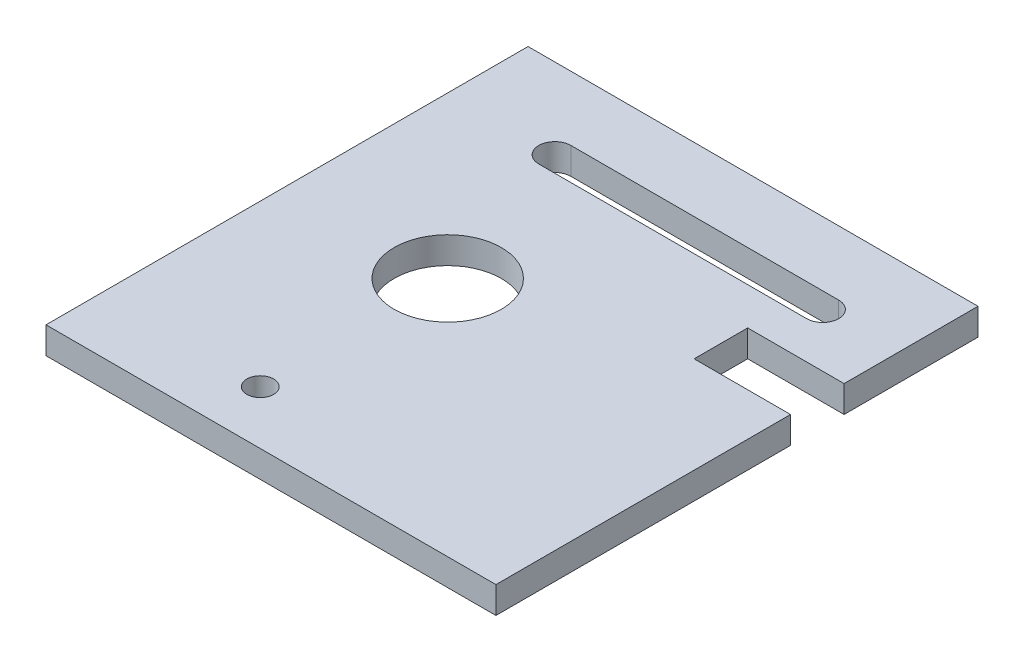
SolidWorks part; units mm, degrees
ref_plane "Front Plane" through (0, 0, 0) normal (0, 0, 1) x (1, 0, 0)
ref_plane "Top Plane" through (0, 0, 0) normal (0, 1, 0) x (1, 0, 0)
ref_plane "Right Plane" through (0, 0, 0) normal (1, 0, 0) x (0, 0, -1)
sketch "Sketch1" plane through (0, 0, 0) normal (0, 1, 0) x (1, 0, 0)
  line L0 (0, 45) -> (84, 45) construction
  line L1 (0, 0) -> (84, 0)
  line L2 (0, 0) -> (0, 90)
  line L3 (0, 90) -> (84, 90)
  line L4 (84, 0) -> (84, 90)
  circle A0 centre (30, 45) radius 10
  dimension "D3" = 30
  dimension "D4" = 20
  dimension "D1" = 84
  dimension "D2" = 90
extrude "Extrude1" add sketch "Sketch1" along normal blind 5
sketch "Sketch2" plane through (0, 5, 0) normal (0, 1, 0) x (1, 0, 0)
  line L0 (0, 90) -> (0, 0) construction
  line L1 (0, 0) -> (84, 0) construction
  point P0 (30, 10)
  dimension "D1" = 30
  dimension "D2" = 10
hole_wizard "M6 Tapped Hole1" positions "3DSketch1" profile "Sketch3" tap size "M6" standard "ISO"
sketch3d "3DSketch1"
  point P0 (30, 5, -10)
sketch "Sketch3" plane through (30, 5, -10) normal (1, 0, 0) x (0, 0, 1)
  line L0 (0, 0) -> (0, 5)
  line L1 (0, 5) -> (2.5, 5)
  line L2 (2.5, 5) -> (2.5, 0)
  line L5 (2.5, 0) -> (0, 0)
  line L11 (0, -6.35) -> (0, 107.95) construction
  dimension "Thru Tap Drill Dia." = 5
  dimension "Thru Tap Drill Depth" = 5
sketch "Sketch4" plane through (0, 5, 0) normal (0, 1, 0) x (1, 0, 0)
  line L0 (84, 0) -> (84, 90) construction
  line L1 (84, 65) -> (66, 65)
  line L2 (84, 65) -> (84, 55)
  line L3 (84, 55) -> (66, 55)
  line L4 (66, 65) -> (66, 55)
  line L5 (84, 90) -> (0, 90) construction
  line L6 (20, 75) -> (70, 75) construction
  line L7 (20, 78) -> (70, 78)
  line L8 (20, 72) -> (70, 72)
  line L9 (0, 90) -> (0, 0) construction
  arc A0 (20, 78) -> (20, 72) centre (20, 75) ccw
  arc A1 (70, 72) -> (70, 78) centre (70, 75) ccw
  point P10 (45, 75)
  dimension "D4" = 3
  dimension "D1" = 25
  dimension "D2" = 10
  dimension "D3" = 18
  dimension "D5" = 50
  dimension "D6" = 20
  dimension "D7" = 15
extrude "Cut-Extrude1" cut sketch "Sketch4" against normal through all
